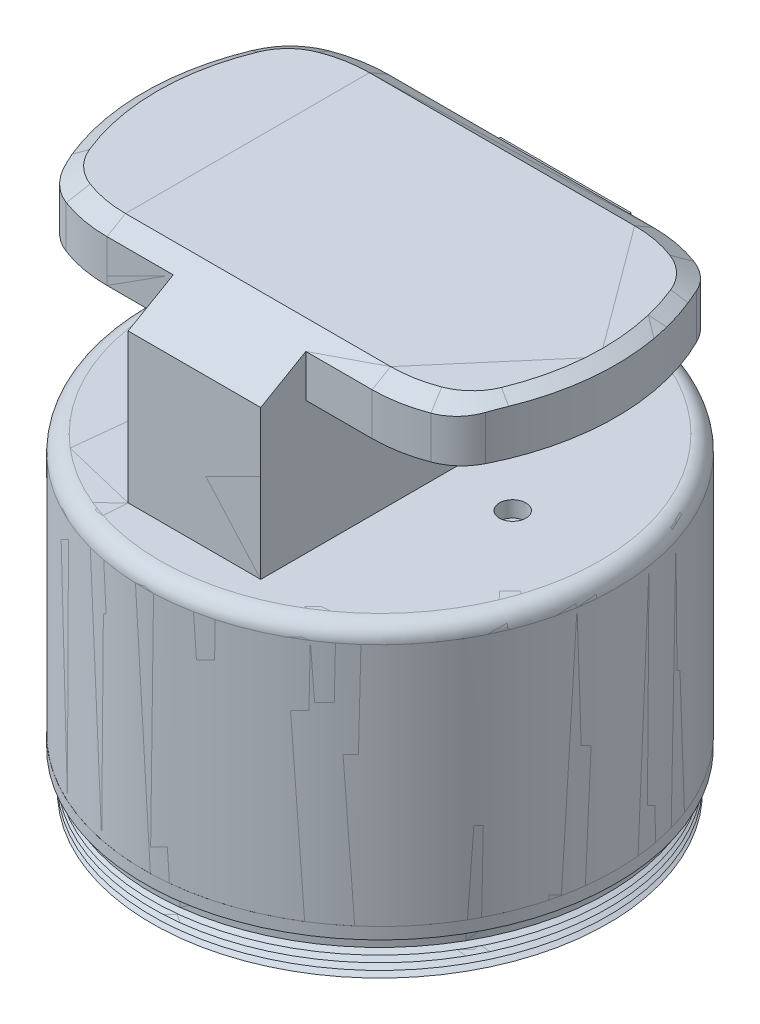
SolidWorks part; units mm, degrees
ref_plane "Front Plane" through (0, 0, 0) normal (0, 0, 1) x (1, 0, 0)
ref_plane "Top Plane" through (0, 0, 0) normal (0, 1, 0) x (1, 0, 0)
ref_plane "Right Plane" through (0, 0, 0) normal (1, 0, 0) x (0, 0, -1)
imported_body "Imported1"
ref_plane "Plane1" through (0, 0, -4) normal (0, 0, 1) x (1, 0, 0)
sketch "Sketch2" plane through (0, -54.5, 0) normal (0, -1, 0) x (1, 0, 0)
  circle A0 centre (-8.4115, -3.9885) radius 1 construction
  circle A1 centre (8.3885, -3.9885) radius 1 construction
  circle A2 centre (-8.4115, -3.9885) radius 1
  circle A3 centre (8.3885, -3.9885) radius 1
extrude "Extrude1" add sketch "Sketch2" along normal up to surface (2 mm away)
sketch "Sketch1" plane through (0, 0, -4) normal (0, 0, 1) x (1, 0, 0)
  line L0 (-8.5, -58.5042) -> (-8.5, -49.1811) construction
  line L1 (0, -48.9016) -> (0, 48.9016) construction
  line L2 (-9.75, -56.5) -> (-9.3603, -56.275)
  line L3 (-13.0115, -56.5) -> (12.9885, -56.5) construction
  line L4 (-9.3603, -56.275) -> (-8.5, -56.275)
  line L5 (-8.5, -56.275) -> (-8.5, -56.725)
  line L6 (-8.5, -56.725) -> (-9.3603, -56.725)
  line L7 (-9.3603, -56.725) -> (-9.75, -56.5)
  dimension "D1" = 8.5
  dimension "D2" = 2.5
  dimension "D3" = 0.45
revolve "Cut-Revolve1" cut sketch "Sketch1" angle 360 about L0
pattern_linear "LPattern1" count 5 spacing 0.45 along (0, 1, 0) of "Cut-Revolve1"
mirror "Mirror1" about plane through (0, 0, 0) normal (1, 0, 0) of "Cut-Revolve1", "LPattern1"
